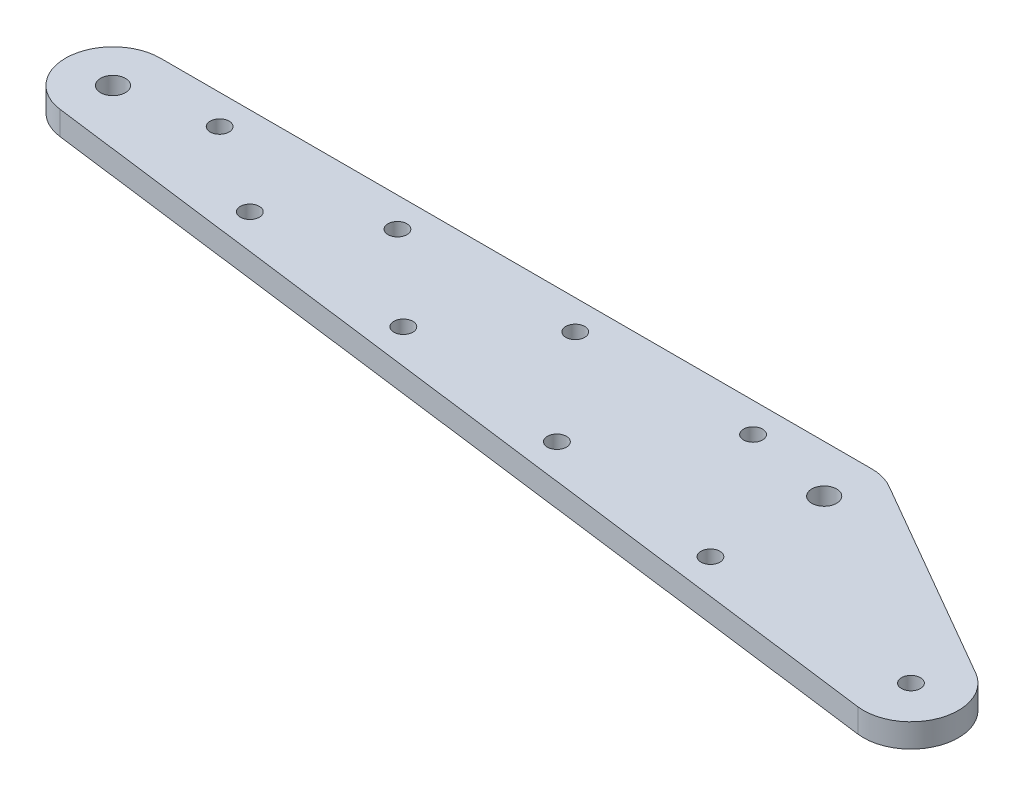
SolidWorks part; units mm, degrees
ref_plane "前视基准面" through (0, 0, 0) normal (0, 0, 1) x (1, 0, 0)
ref_plane "上视基准面" through (0, 0, 0) normal (0, 1, 0) x (1, 0, 0)
ref_plane "右视基准面" through (0, 0, 0) normal (1, 0, 0) x (0, 0, -1)
other "Configuration Table"
sketch "草图1" plane through (0, 0, 0) normal (0, 1, 0) x (1, 0, 0)
  line L0 (153.6149, -27.9339) -> (-1.0261, -7.9339)
  line L3 (0, 8) -> (120, 8)
  line L4 (124, 6.9282) -> (158.641, -13.0718)
  circle A2 centre (0, 0) radius 2.1
  circle A3 centre (154.641, -20) radius 1.6
  circle A4 centre (120, 0) radius 2.1
  arc A5 (-1.0261, -7.9339) -> (0, 8) centre (0, 0) cw
  arc A6 (120, 8) -> (124, 6.9282) centre (120, 0) cw
  arc A7 (158.641, -13.0718) -> (153.6149, -27.9339) centre (154.641, -20) cw
  dimension "D3" = 4.2
  dimension "D4" = 8
  dimension "D5" = 8
  dimension "D6" = 8
  dimension "D7" = 150
  dimension "D8" = 3.2
  dimension "D1" = 120
  dimension "D2" = 40
extrude "凸台-拉伸1" add sketch "草图1" along normal blind 4
sketch "草图2" plane through (0, 4, 0) normal (0, 1, 0) x (1, 0, 0)
  line L0 (15, 3) -> (45, 3) construction
  line L1 (30, -6.9049) -> (59.7522, -10.7528) construction
  line L3 (120, 8) -> (0, 8) construction
  line L4 (-1.0261, -7.9339) -> (153.6149, -27.9339) construction
  circle A0 centre (15, 3) radius 1.6
  circle A1 centre (45, 3) radius 1.6
  circle A2 centre (75, 3) radius 1.6
  circle A3 centre (105, 3) radius 1.6
  circle A9 centre (30, -6.9049) radius 1.6
  circle A10 centre (59.7522, -10.7528) radius 1.6
  circle A11 centre (89.5044, -14.6008) radius 1.6
  circle A12 centre (119.2566, -18.4487) radius 1.6
  point P22 (0, 0)
  point P23 (30, 3)
  dimension "D4" = 4
  dimension "D5" = 5
  dimension "D8" = 3.2
  dimension "D1" = 30
  dimension "D2" = 30
  dimension "D3" = 15
  dimension "D6" = 5
  dimension "D7" = 4
extrude "切除-拉伸1" cut sketch "草图2" against normal through all
